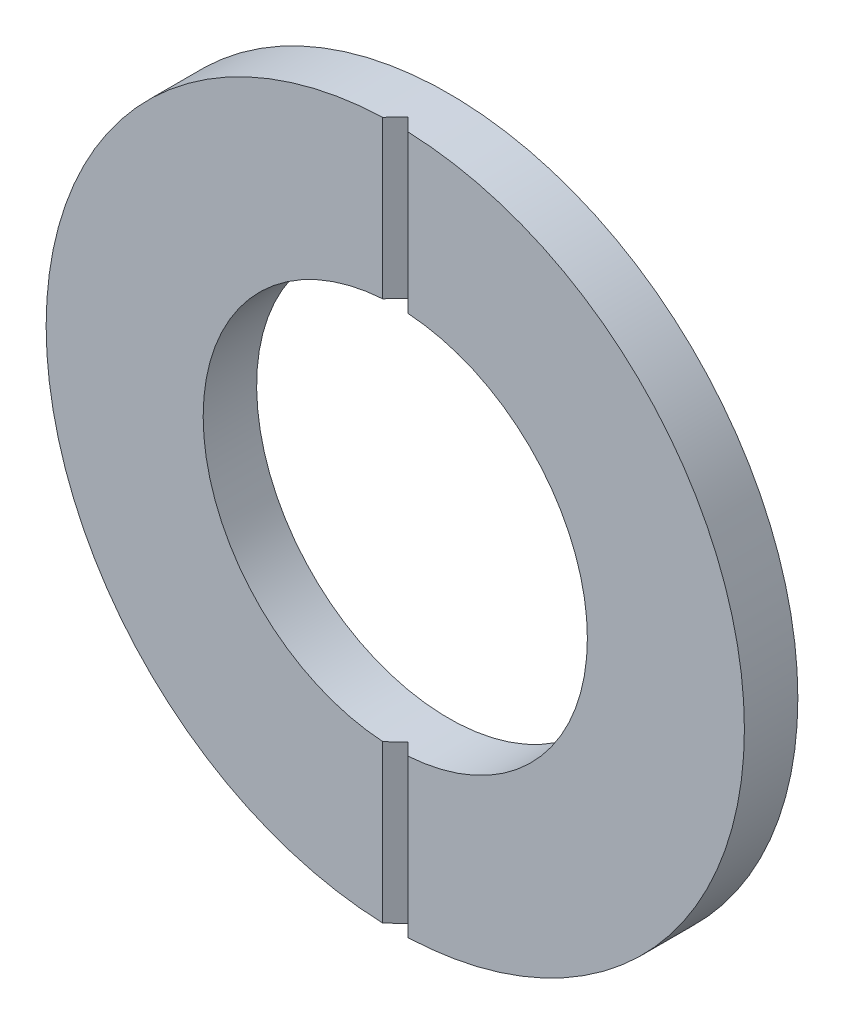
SolidWorks part; units mm, degrees
ref_plane "XY" through (0, 0, 0) normal (0, 0, 1) x (1, 0, 0)
ref_plane "XZ" through (0, 0, 0) normal (0, 1, 0) x (1, 0, 0)
ref_plane "YZ" through (0, 0, 0) normal (1, 0, 0) x (0, 0, -1)
sketch "Sketch1" plane through (0, 0, 0) normal (0, 0, 1) x (1, 0, 0)
  circle A0 centre (0, 0) radius 2.6543
  circle A1 centre (0, 0) radius 1.4605
  dimension "D1" = 5.3086
  dimension "D2" = 2.921
extrude "OD_MMC - ID_NOM" add sketch "Sketch1" along normal blind 0.4064
sketch "Sketch2" plane through (0, 0, 0) normal (0, 1, 0) x (1, 0, 0)
  line L0 (-0.0952, -0.4064) -> (0.0953, -0.4064)
  line L1 (-0.0952, -0.4064) -> (0, -0.3111)
  line L2 (0, -0.3111) -> (0.0953, -0.4064)
  line L3 (0, -0.3111) -> (0, -0.4064) construction
  line L4 (-2.6543, -0.4064) -> (2.6543, -0.4064) construction
  line L5 (0, -50) -> (0, 50) construction
  dimension "D1" = 0.1905
  dimension "D2" = 45
extrude "Extrude1" cut sketch "Sketch2" against normal through all and the other way through all
